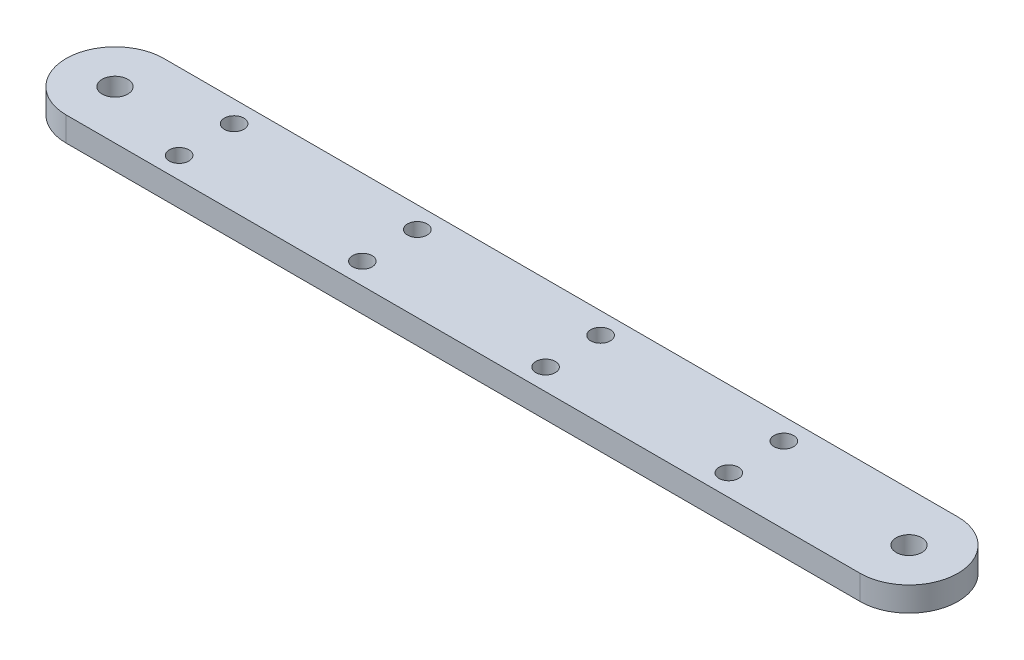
SolidWorks part; units mm, degrees
ref_plane "前视基准面" through (0, 0, 0) normal (0, 0, 1) x (1, 0, 0)
ref_plane "上视基准面" through (0, 0, 0) normal (0, 1, 0) x (1, 0, 0)
ref_plane "右视基准面" through (0, 0, 0) normal (1, 0, 0) x (0, 0, -1)
other "Configuration Table"
sketch "草图1" plane through (0, 0, 0) normal (0, 1, 0) x (1, 0, 0)
  line L0 (-65, 0) -> (65, 0) construction
  line L1 (-65, 8) -> (65, 8)
  line L2 (-65, -8) -> (65, -8)
  arc A0 (-65, 8) -> (-65, -8) centre (-65, 0) ccw
  arc A1 (65, -8) -> (65, 8) centre (65, 0) ccw
  circle A2 centre (-65, 0) radius 2.1
  circle A3 centre (65, 0) radius 2.1
  point P3 (0, 0)
  dimension "D2" = 4.2
  dimension "D3" = 4.2
  dimension "D1" = 130
  dimension "D4" = 16
extrude "凸台-拉伸1" add sketch "草图1" along normal blind 4
sketch "草图2" plane through (0, 4, 0) normal (0, 1, 0) x (1, 0, 0)
  line L0 (65, 8) -> (-65, 8) construction
  line L1 (-50, 4.5) -> (-20, 4.5) construction
  line L2 (-50, 4.5) -> (-50, -4.5) construction
  circle A0 centre (-50, 4.5) radius 1.6
  circle A1 centre (-20, 4.5) radius 1.6
  circle A2 centre (10, 4.5) radius 1.6
  circle A3 centre (40, 4.5) radius 1.6
  circle A4 centre (-20, -4.5) radius 1.6
  circle A5 centre (10, -4.5) radius 1.6
  circle A6 centre (40, -4.5) radius 1.6
  circle A7 centre (-50, -4.5) radius 1.6
  point P0 (0, 0)
  point P4 (-59.5031, 4.5)
  dimension "D1" = 3.2
  dimension "D8" = 4
  dimension "D2" = 3.5
  dimension "D4" = 90
  dimension "D5" = 20
  dimension "D6" = 9
  dimension "D7" = 30
  dimension "D3" = 2
extrude "切除-拉伸1" cut sketch "草图2" against normal through all
